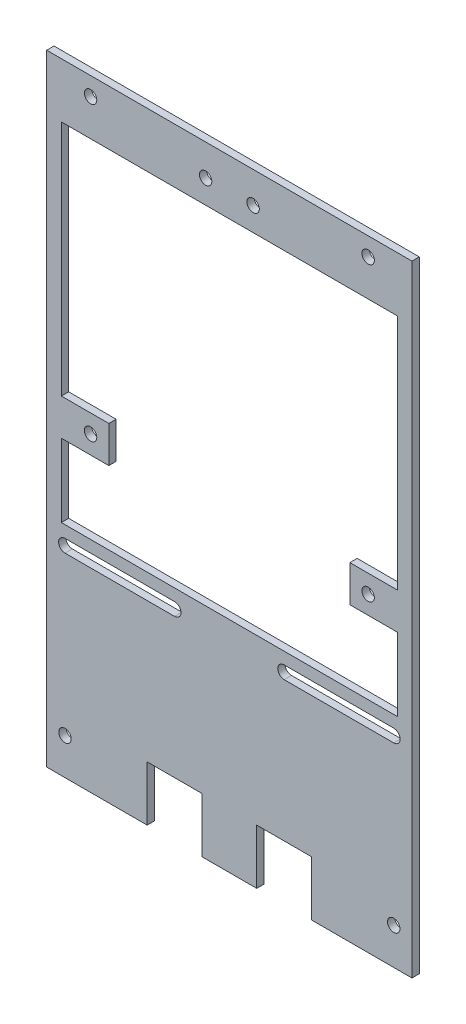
SolidWorks part; units mm, degrees
ref_plane "前视基准面" through (0, 0, 0) normal (0, 0, 1) x (1, 0, 0)
ref_plane "上视基准面" through (0, 0, 0) normal (0, 1, 0) x (1, 0, 0)
ref_plane "右视基准面" through (0, 0, 0) normal (1, 0, 0) x (0, 0, -1)
sketch "草图1" plane through (0, 0, 0) normal (0, 0, 1) x (1, 0, 0)
  line L1 (-50, 85) -> (50, 85)
  line L2 (-50, 85) -> (-50, -85)
  line L3 (-50, -85) -> (50, -85)
  line L4 (50, 85) -> (50, -85)
  line L5 (-50, 85) -> (50, -85) construction
  line L6 (-50, -85) -> (50, 85) construction
  point P0 (0, 0)
  dimension "D1" = 100
  dimension "D2" = 170
extrude "凸台-拉伸1" add sketch "草图1" along normal blind 2
sketch "草图2" plane through (0, 0, 2) normal (0, 0, 1) x (1, 0, 0)
  line L0 (-50, -85) -> (50, -85) construction
  line L1 (-22.5, -100) -> (-7.5, -100)
  line L2 (-22.5, -100) -> (-22.5, -70)
  line L3 (-22.5, -70) -> (-7.5, -70)
  line L4 (-7.5, -100) -> (-7.5, -70)
  line L5 (-22.5, -100) -> (-7.5, -70) construction
  line L6 (-22.5, -70) -> (-7.5, -100) construction
  line L8 (7.5, -100) -> (22.5, -100)
  line L9 (7.5, -100) -> (7.5, -70)
  line L10 (7.5, -70) -> (22.5, -70)
  line L11 (22.5, -100) -> (22.5, -70)
  line L12 (7.5, -100) -> (22.5, -70) construction
  line L13 (7.5, -70) -> (22.5, -100) construction
  point P0 (-15, -85)
  point P7 (15, -85)
  point P12 (0, -85)
  dimension "D1" = 15
  dimension "D2" = 15
  dimension "D3" = 15
  dimension "D4" = 7.5
  dimension "D5" = 30
  dimension "D6" = 30
extrude "切除-拉伸1" cut sketch "草图2" against normal blind 3
hole_wizard "Ø3.4 (3.4) 直径孔1" positions "草图3" profile "草图4" hole size "Ø3.4" standard "GB"
sketch "草图3" plane through (0, 0, 2) normal (0, 0, 1) x (1, 0, 0)
  point P0 (-6.5, 76.4436)
  point P3 (6.5, 76.4436)
sketch "草图4" plane through (-6.5, 76.4436, 2) normal (1, 0, 0) x (0, -1, 0)
  line L0 (0, 0) -> (0, 2)
  line L1 (0, 2) -> (1.7, 2)
  line L2 (1.7, 2) -> (1.7, 0)
  line L5 (1.7, 0) -> (0, 0)
  line L11 (0, -6.35) -> (0, 107.95) construction
  dimension "通孔孔直径" = 3.4
  dimension "通孔孔深度" = 2
hole_wizard "Ø3.4 (3.4) 直径孔2" positions "草图5" profile "草图6" hole size "Ø3.4" standard "GB"
sketch "草图5" plane through (0, 0, 2) normal (0, 0, 1) x (1, 0, 0)
  point P0 (-45, -75)
  point P3 (45, -75)
sketch "草图6" plane through (-45, -75, 2) normal (1, 0, 0) x (0, -1, 0)
  line L0 (0, 0) -> (0, 2)
  line L1 (0, 2) -> (1.7, 2)
  line L2 (1.7, 2) -> (1.7, 0)
  line L5 (1.7, 0) -> (0, 0)
  line L11 (0, -6.35) -> (0, 107.95) construction
  dimension "通孔孔直径" = 3.4
  dimension "通孔孔深度" = 2
hole_wizard "Ø3.4 (3.4) 直径孔3" positions "草图7" profile "草图8" hole size "Ø3.4" standard "GB"
sketch "草图7" plane through (0, 0, 2) normal (0, 0, 1) x (1, 0, 0)
  point P0 (-38, 80)
  point P3 (38, 80)
  point P6 (-38, 0)
  point P9 (38, 0)
sketch "草图8" plane through (-38, 80, 2) normal (1, 0, 0) x (0, -1, 0)
  line L0 (0, 0) -> (0, 2)
  line L1 (0, 2) -> (1.7, 2)
  line L2 (1.7, 2) -> (1.7, 0)
  line L5 (1.7, 0) -> (0, 0)
  line L11 (0, -6.35) -> (0, 107.95) construction
  dimension "通孔孔直径" = 3.4
  dimension "通孔孔深度" = 2
sketch "草图9" plane through (0, 0, 2) normal (0, 0, 1) x (1, 0, 0)
  line L0 (-50, 85) -> (-50, -85) construction
  line L1 (-46, -5) -> (-33, -5)
  line L2 (-46, -5) -> (-46, -25)
  line L3 (-46, -25) -> (46, -25)
  line L4 (46, -5) -> (46, -25)
  line L5 (50, -85) -> (50, 85) construction
  line L6 (22.5, -85) -> (50, -85) construction
  line L7 (50, 85) -> (-50, 85) construction
  line L8 (-33, 70) -> (33, 70)
  line L9 (-33, 5) -> (-33, -5)
  line L11 (33, 5) -> (33, -5)
  line L12 (33, -5) -> (46, -5)
  line L13 (-46, 70) -> (46, 70)
  line L14 (-46, 70) -> (-46, 5)
  line L15 (-46, 5) -> (46, 5)
  line L16 (46, 70) -> (46, 5)
  dimension "D1" = 4
  dimension "D2" = 4
  dimension "D3" = 60
  dimension "D4" = 20
  dimension "D5" = 15
  dimension "D6" = 17
  dimension "D7" = 17
  dimension "D8" = 4
  dimension "D9" = 4
  dimension "D10" = 65
  dimension "D11" = 0
extrude "切除-拉伸2" cut sketch "草图9" against normal up to next contours L16 L13 L8 L14 L15 | L15 L9 L1 L2 L3 L4 L12 L11
sketch "草图10" plane through (0, 0, 2) normal (0, 0, 1) x (1, 0, 0)
  line L0 (-45, -30) -> (-15, -30) construction
  line L1 (-45, -28.25) -> (-15, -28.25)
  line L2 (-45, -31.75) -> (-15, -31.75)
  line L3 (15, -30) -> (45, -30) construction
  line L4 (15, -28.25) -> (45, -28.25)
  line L5 (15, -31.75) -> (45, -31.75)
  line L6 (-46, -25) -> (46, -25) construction
  line L7 (50, -85) -> (50, 85) construction
  line L8 (-50, 85) -> (-50, -85) construction
  arc A0 (-45, -28.25) -> (-45, -31.75) centre (-45, -30) ccw
  arc A1 (-15, -31.75) -> (-15, -28.25) centre (-15, -30) ccw
  arc A2 (15, -28.25) -> (15, -31.75) centre (15, -30) ccw
  arc A3 (45, -31.75) -> (45, -28.25) centre (45, -30) ccw
  point P2 (-30, -30)
  point P7 (30, -30)
  dimension "D7" = 1.75
  dimension "D8" = 1.75
  dimension "D1" = 30
  dimension "D2" = 5
  dimension "D3" = 30
  dimension "D4" = 5
  dimension "D5" = 5
  dimension "D6" = 5
extrude "切除-拉伸3" cut sketch "草图10" against normal up to next
